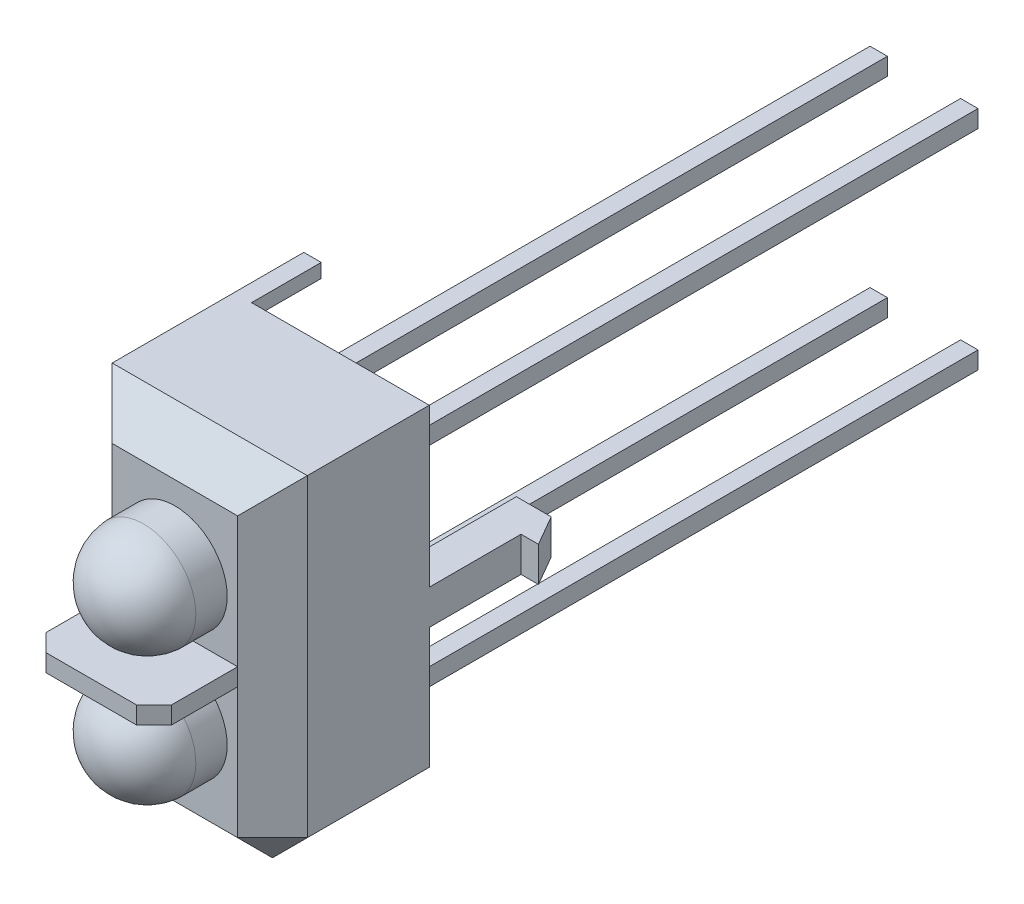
SolidWorks part; units mm, degrees
ref_plane "Front Plane" through (0, 0, 0) normal (0, 0, 1) x (1, 0, 0)
ref_plane "Top Plane" through (0, 0, 0) normal (0, 1, 0) x (1, 0, 0)
ref_plane "Right Plane" through (0, 0, 0) normal (1, 0, 0) x (0, 0, -1)
sketch "Sketch1" plane through (0, 0, 0) normal (0, 0, 1) x (1, 0, 0)
  line L1 (-2.8, 5) -> (2.8, 5)
  line L2 (-2.8, 5) -> (-2.8, -5)
  line L3 (-2.8, -5) -> (2.8, -5)
  line L4 (2.8, 5) -> (2.8, -5)
  line L5 (-2.8, 5) -> (2.8, -5) construction
  line L6 (-2.8, -5) -> (2.8, 5) construction
  point P0 (0, 0)
  dimension "D1" = 10
  dimension "D2" = 5.6
extrude "Boss-Extrude1" add sketch "Sketch1" along normal blind 4.5
chamfer "Chamfer1" distance 1 angle 45 6 edges at (2.8, -5, 2.25) (-2.8, -5, 2.25) (2.8, 0, 4.5) (0, -5, 4.5) (0, 5, 4.5) (-2.8, 0, 4.5)
sketch "Sketch2" plane through (0, 0, 4.5) normal (0, 0, 1) x (1, 0, 0)
  line L0 (0, 1.85) -> (0, -1.85) construction
  line L1 (-1.6378, 0) -> (1.752, 0) construction
  circle A0 centre (0, 1.85) radius 1.5
  circle A1 centre (0, -1.85) radius 1.5
  dimension "D2" = 3
  dimension "D3" = 3
  dimension "D1" = 3.7
extrude "Boss-Extrude2" add sketch "Sketch2" along normal blind 0.9
dome "Dome1" faces to dome 2 distance 1.4 parameters "D1"=1.4
dome "Dome2" faces to dome 2 distance 1.4 parameters "D1"=1.4
sketch "Sketch3" plane through (0, 0, 4.5) normal (0, 0, 1) x (1, 0, 0)
  line L0 (1.8, -4) -> (1.8, 4) construction
  line L1 (-1.8, -0.25) -> (1.8, -0.25)
  line L2 (-1.8, -0.25) -> (-1.8, 0.25)
  line L3 (-1.8, 0.25) -> (1.8, 0.25)
  line L4 (1.8, -0.25) -> (1.8, 0.25)
  line L5 (-1.8, -0.25) -> (1.8, 0.25) construction
  line L6 (-1.8, 0.25) -> (1.8, -0.25) construction
  point P0 (0, 0)
  dimension "D1" = 0.5
extrude "Boss-Extrude3" add sketch "Sketch3" along normal blind 2.4
chamfer "Chamfer2" distance 0.5 angle 45 2 edges at (-1.8, 0, 6.9) (1.8, 0, 6.9)
sketch "Sketch4" plane through (2.8, 0, 0) normal (1, 0, 0) x (0, 0, -1)
  line L0 (3.5, 0.477) -> (0, 0.477)
  line L1 (0, 0.477) -> (0, -0.523)
  line L2 (3.5, 0.477) -> (3.5, -0.523)
  line L3 (0, -0.523) -> (3.5, -0.523)
extrude "Boss-Extrude4" add sketch "Sketch4" against normal blind 1
sketch "Sketch5" plane through (0, -0.523, 0) normal (0, -1, 0) x (1, 0, 0)
  line L0 (2.8, 0) -> (2.8, -3.5) construction
  line L1 (2.8, -2.634) -> (2.8, -3.5)
  line L2 (2.8, -3.5) -> (3.3, -2.634)
  line L3 (3.3, -2.634) -> (2.8, -2.634)
extrude "Boss-Extrude5" add sketch "Sketch5" against normal up to surface (1 mm away)
ref_plane "Plane1" through (0, 0, 0) normal (1, 0, 0) x (0, 0, -1)
mirror "Mirror1" about plane through (0, 0, 0) normal (1, 0, 0) of "Boss-Extrude5", "Boss-Extrude4"
sketch "Sketch6" plane through (-2.8, 0, 0) normal (-1, 0, 0) x (0, 0, 1)
  line L0 (0, 5) -> (-2, 5)
  line L1 (-2, 5) -> (-2, 4.6)
  line L2 (-2, 4.6) -> (0, 4.6)
  line L3 (0, 5) -> (0, 0.477) construction
  line L4 (0, 4.6) -> (0, 5)
extrude "Boss-Extrude6" add sketch "Sketch6" against normal blind 0.5
sketch "Sketch7" plane through (0, 0, 0) normal (0, 0, -1) x (-1, 0, 0)
  line L4 (1.05, 2.75) -> (1.55, 2.75)
  line L5 (1.05, 2.75) -> (1.05, 3.25)
  line L6 (1.05, 3.25) -> (1.55, 3.25)
  line L7 (1.55, 2.75) -> (1.55, 3.25)
  line L8 (1.05, 2.75) -> (1.55, 3.25) construction
  line L9 (1.05, 3.25) -> (1.55, 2.75) construction
extrude "Boss-Extrude7" add sketch "Sketch7" along normal blind 17
ref_plane "Plane2" through (0, 0, 0) normal (1, 0, 0) x (0, 0, -1)
ref_plane "Plane3" through (0, 0, 0) normal (0, -1, 0) x (-1, 0, 0)
mirror "Mirror2" about plane through (0, 0, 0) normal (1, 0, 0) of "Boss-Extrude7"
mirror "Mirror3" about plane through (0, 0, 0) normal (0, -1, 0) of "Boss-Extrude7", "Mirror2"
